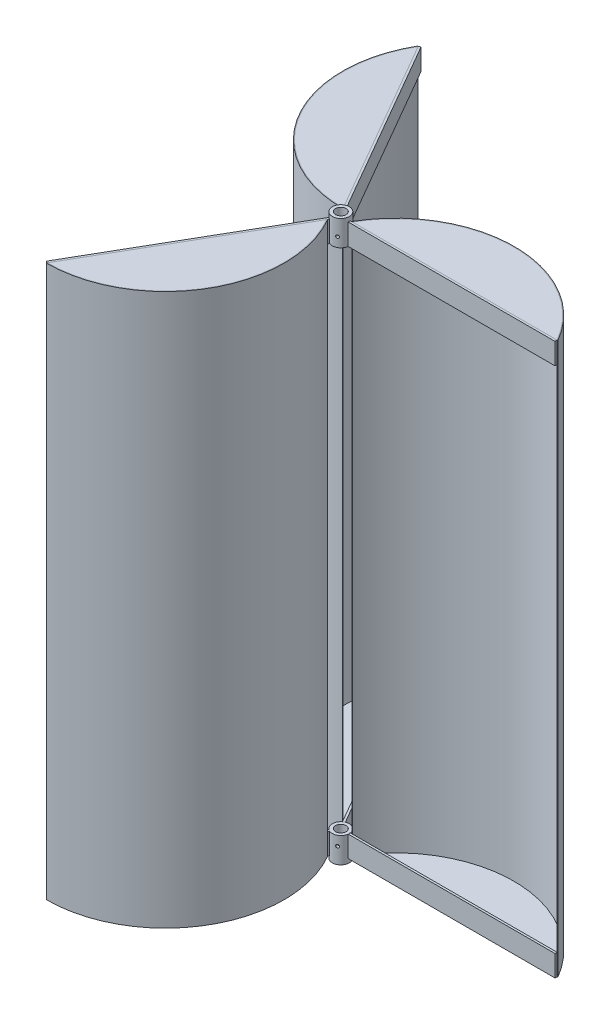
SolidWorks part; units mm, degrees
ref_plane "Front Plane" through (0, 0, 0) normal (0, 0, 1) x (1, 0, 0)
ref_plane "Top Plane" through (0, 0, 0) normal (0, 1, 0) x (1, 0, 0)
ref_plane "Right Plane" through (0, 0, 0) normal (1, 0, 0) x (0, 0, -1)
sketch "Sketch1" plane through (0, 0, 0) normal (0, 1, 0) x (1, 0, 0)
  circle A0 centre (0, 0) radius 12.5
  circle A1 centre (0, 0) radius 20
  dimension "D1" = 25
  dimension "D2" = 40
extrude "Boss-Extrude1" add sketch "Sketch1" along normal blind 60
sketch "Sketch2" plane through (0, 0, 0) normal (0, -1, 0) x (1, 0, 0)
  line L0 (0, 0) -> (507.5, 0) construction
  line L1 (19.8431, -2.5) -> (507.5, -2.5)
  line L2 (19.8431, 2.5) -> (507.5, 2.5)
  line L3 (0, 2.5) -> (507.5, 2.5) construction
  line L4 (0, -2.5) -> (507.5, -2.5) construction
  line L5 (507.5, -2.5) -> (507.5, 2.5)
  circle A0 centre (0, 0) radius 20 construction
  arc A1 (19.8431, -2.5) -> (19.8431, 2.5) centre (0, 0) ccw
  dimension "D1" = 507.5
  dimension "D2" = 2.5
  dimension "D3" = 2.5
extrude "Boss-Extrude2" add sketch "Sketch2" against normal blind 50 separate body
pattern_circular "CirPattern1" count 3 over 360 about axis through (0, 0, 0) along (0, 1, 0)
sketch "Sketch3" plane through (0, 50, 0) normal (0, 1, 0) x (1, 0, 0)
  line L0 (19.8431, 2.5) -> (507.5, 2.5) construction
  line L1 (24.9506, 2.5) -> (507.5, 2.5)
  arc A0 (507.5, 2.5) -> (24.9506, 2.5) centre (266.2253, -136.8) ccw
  point P3 (266.2253, 141.8)
  dimension "D1" = 278.6
  dimension "D2" = 139.3
extrude "Boss-Extrude3" add sketch "Sketch3" against normal blind 5 separate body
sketch "Sketch5" plane through (0, 50, 0) normal (0, 1, 0) x (1, 0, 0)
  line L0 (23.6516, 3.25) -> (24.9506, 2.5)
  line L1 (507.5, 2.5) -> (508.799, 3.25)
  arc A0 (507.5, 2.5) -> (24.9506, 2.5) centre (266.2253, -136.8) ccw construction
  arc A1 (507.5, 2.5) -> (24.9506, 2.5) centre (266.2253, -136.8) ccw
  arc A2 (508.799, 3.25) -> (23.6516, 3.25) centre (266.2253, -136.8) ccw
  dimension "D1" = 1.5
extrude "Boss-Extrude5" add sketch "Sketch5" against normal blind 1300 separate body
pattern_circular "CirPattern2" count 3 over 360 about axis through (0, 0, 0) along (0, 1, 0)
ref_plane "Plane1" through (0, -600, 0) normal (0, 1, 0) x (1, 0, 0)
hole_wizard "M8x1.0 Tapped Hole1" positions "3DSketch2" profile "Sketch6" tap size "M8x1.0" standard "ISO"
sketch3d "3DSketch2"
  point P0 (-19.9988, 22.3607, -0.2203)
  dimension "D1" = 30
sketch "Sketch6" plane through (-19.9988, 22.3607, -0.2203) normal (0, 1, 0) x (-0.011, 0, 0.9999)
  line L0 (0, 0) -> (0, 19)
  line L1 (0, 19) -> (3.5, 16.897)
  line L2 (3.5, 16.897) -> (3.5, 0)
  line L5 (3.5, 0) -> (0, 0)
  line L10 (0, 19) -> (-3.5, 16.897) construction
  line L11 (0, -6.35) -> (0, 107.95) construction
  dimension "Tap Drill Dia." = 7
  dimension "Tap Drill Depth" = 19
  dimension "Drill Angle" = 118
pattern_circular "CirPattern3" count 2 every 120 about axis through (0, 0, 0) along (0, 1, 0) of "M8x1.0 Tapped Hole1"
mirror "Mirror1" about plane through (0, -600, 0) normal (0, 1, 0)
